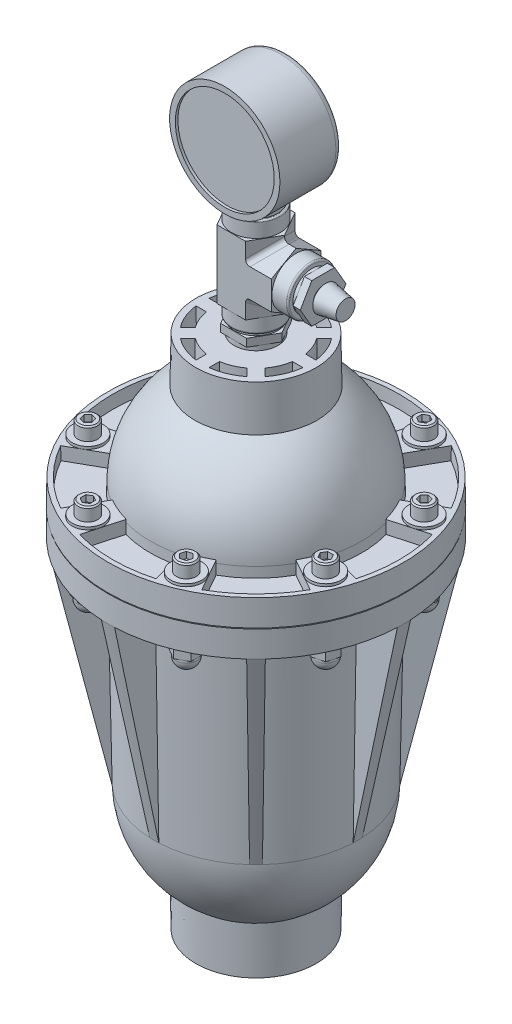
SolidWorks part; units mm, degrees
ref_plane "Front Plane" through (0, 0, 0) normal (0, 0, 1) x (1, 0, 0)
ref_plane "Top Plane" through (0, 0, 0) normal (0, 1, 0) x (1, 0, 0)
ref_plane "Right Plane" through (0, 0, 0) normal (1, 0, 0) x (0, 0, -1)
sketch "Sketch1" plane through (0, 0, 0) normal (0, 1, 0) x (1, 0, 0)
  circle A0 centre (0, 0) radius 72.39
  circle A1 centre (0, 0) radius 69.723
  dimension "D1" = 144.78
  dimension "D2" = 2.667
extrude "Boss-Extrude1" add sketch "Sketch1" along normal blind 12.7 draft 1
ref_plane "Plane1" through (0, -0.508, 0) normal (0, 1, 0) x (1, 0, 0)
sketch "Sketch5" plane through (0, 0, 0) normal (0, 1, 0) x (1, 0, 0)
  circle A0 centre (0, 0) radius 72.2624
extrude "Boss-Extrude5" add sketch "Sketch5" along normal blind 6.35
sketch "Sketch6" plane through (0, -0.508, 0) normal (0, 1, 0) x (1, 0, 0)
  circle A0 centre (0, 0) radius 59.4995
  dimension "D1" = 118.999
extrude "Boss-Extrude6" add sketch "Sketch6" along normal blind 6.35
sketch "Sketch7" plane through (0, -0.508, 0) normal (0, 1, 0) x (1, 0, 0)
  circle A0 centre (0, 0) radius 72.263
  circle A1 centre (0, 0) radius 69.596
  dimension "D1" = 2.667
extrude "Boss-Extrude7" add sketch "Sketch7" against normal blind 12.7 separate body
sketch "Sketch8" plane through (0, -0.508, 0) normal (0, 1, 0) x (1, 0, 0)
  circle A0 centre (0, 0) radius 72.263
extrude "Boss-Extrude8" add sketch "Sketch8" against normal blind 6.35 draft 1
sketch "Sketch9" plane through (0, 0, 0) normal (0, 1, 0) x (1, 0, 0)
  circle A0 centre (0, 0) radius 51.689
  dimension "D1" = 103.378
extrude "Boss-Extrude9" add sketch "Sketch9" along normal blind 59.944 draft 1
sketch "Sketch10" plane through (0, -0.508, 0) normal (0, 1, 0) x (1, 0, 0)
  circle A0 centre (0, 0) radius 51.689
extrude "Boss-Extrude10" add sketch "Sketch10" against normal blind 164.211 draft 1
ref_plane "Plane2" through (0, 73.533, 0) normal (0, 1, 0) x (1, 0, 0)
fillet "Fillet1" radius 49.53 2 edges at (0, -164.719, 48.8227) (0, 59.944, 50.6427)
ref_plane "Plane3" through (0, -178.308, 0) normal (0, 1, 0) x (1, 0, 0)
sketch "Sketch11" plane through (0, 73.533, 0) normal (0, 1, 0) x (1, 0, 0)
  circle A0 centre (0, 0) radius 29.337
  dimension "D1" = 58.674
extrude "Boss-Extrude11" add sketch "Sketch11" against normal up to surface (86.741 mm away) draft 1
sketch "Sketch12" plane through (0, -178.308, 0) normal (0, 1, 0) x (1, 0, 0)
  circle A0 centre (0, 0) radius 29.337
  dimension "D1" = 58.674
extrude "Boss-Extrude12" add sketch "Sketch12" along normal up to surface (191.008 mm away) draft 1
sketch "Sketch13" plane through (0, 73.533, 0) normal (0, 1, 0) x (1, 0, 0)
  circle A0 centre (0, 0) radius 21.209
  circle A1 centre (0, 0) radius 26.289
  dimension "D1" = 42.418
  dimension "D2" = 5.08
extrude "Cut-Extrude1" cut sketch "Sketch13" against normal blind 16.129 draft 1
sketch "Sketch14" plane through (0, -178.308, 0) normal (0, 1, 0) x (1, 0, 0)
  circle A0 centre (0, 0) radius 21.209
  circle A1 centre (0, 0) radius 26.289
  dimension "D1" = 42.418
  dimension "D2" = 5.08
extrude "Cut-Extrude2" cut sketch "Sketch14" along normal blind 16.129 draft 1
sketch "Sketch15" plane through (0, 73.533, 0) normal (0, 1, 0) x (1, 0, 0)
  line L0 (0, 0) -> (-38.2113, 0) construction
  line L1 (-27.5346, 3.175) -> (-18.5716, 3.175)
  line L2 (-18.5716, 3.175) -> (-18.5716, -3.175)
  line L3 (-18.5716, -3.175) -> (-27.5346, -3.175)
  line L4 (-27.5346, -3.175) -> (-27.5346, 3.175)
  dimension "D1" = 3.175
  dimension "D2" = 6.35
extrude "Boss-Extrude13" add sketch "Sketch15" against normal up to surface (16.129 mm away)
pattern_circular "CirPattern1" count 8 over 360 about axis through (0, 0, 0) along (0, 1, 0) of "Boss-Extrude13"
sketch "Sketch16" plane through (0, -178.308, 0) normal (0, 1, 0) x (1, 0, 0)
  line L0 (0, 0) -> (-34.5412, 0) construction
  line L1 (-27.7629, -3.175) -> (-18.9621, -3.175)
  line L2 (-18.9621, -3.175) -> (-18.9621, 3.175)
  line L3 (-18.9621, 3.175) -> (-27.7629, 3.175)
  line L4 (-27.7629, 3.175) -> (-27.7629, -3.175)
  dimension "D1" = 3.175
  dimension "D2" = 6.35
extrude "Boss-Extrude14" add sketch "Sketch16" along normal up to surface (16.129 mm away)
pattern_circular "CirPattern2" count 8 over 360 about axis through (0, 0, 0) along (0, 1, 0) of "Boss-Extrude14"
ref_plane "Plane4" through (0, 12.7, 0) normal (0, 1, 0) x (1, 0, 0)
ref_plane "Plane5" through (0, -13.208, 0) normal (0, 1, 0) x (1, 0, 0)
sketch "Sketch17" plane through (0, 12.7, 0) normal (0, 1, 0) x (1, 0, 0)
  line L0 (0, 0) -> (-75.9907, 0) construction
  line L1 (0, 0) -> (-73.6399, 20.4222) construction
  line L2 (0, 0) -> (-67.2134, 38.0275) construction
  line L3 (-44.5971, 12.3679) -> (-68.9898, 19.1326)
  line L4 (-68.9898, 19.1326) -> (-62.0787, 35.1224)
  line L5 (-62.0787, 35.1224) -> (-40.5245, 22.9277)
  line L6 (-40.5245, 22.9277) -> (-44.5971, 12.3679)
  dimension "D1" = 15.5
  dimension "D2" = 29.5
extrude "Boss-Extrude15" add sketch "Sketch17" against normal up to surface (6.35 mm away)
pattern_circular "CirPattern3" count 8 over 360 about axis through (0, 0, 0) along (0, 1, 0) of "Boss-Extrude15"
sketch "Sketch18" plane through (0, -13.208, 0) normal (0, 1, 0) x (1, 0, 0)
  line L0 (0, 0) -> (-75.9907, 0) construction
  line L1 (0, 0) -> (-73.2368, -20.3104) construction
  line L2 (0, 0) -> (-67.5571, -38.222) construction
  line L3 (-45.1438, -12.5195) -> (-68.6453, -19.037)
  line L4 (-68.6453, -19.037) -> (-62.1614, -35.1692)
  line L5 (-62.1614, -35.1692) -> (-39.9964, -22.6289)
  line L6 (-39.9964, -22.6289) -> (-45.1438, -12.5195)
  dimension "D1" = 15.5
  dimension "D2" = 29.5
extrude "Boss-Extrude16" add sketch "Sketch18" along normal up to surface (6.35 mm away)
pattern_circular "CirPattern4" count 8 over 360 about axis through (0, 0, 0) along (0, 1, 0) of "Boss-Extrude16"
sketch "Sketch19" plane through (0, 0, 0) normal (1, 0, 0) x (0, 0, -1)
  line L0 (-49.6721, -116.0534) -> (-45.7138, -113.2801)
  line L1 (-45.7138, -113.2801) -> (-47.6929, -3.4341)
  line L2 (-47.6929, -3.4341) -> (-69.7298, -3.4341)
  line L3 (-69.7298, -3.4341) -> (-72.263, -13.208)
  line L4 (79.629, -13.208) -> (-79.629, -13.208) construction
  line L5 (-72.263, -0.508) -> (-72.263, -13.208) construction
  line L6 (-72.263, -13.208) -> (-49.6721, -116.0534)
  line L7 (0, 0) -> (0, -189.5381) construction
revolve "Revolve1" add sketch "Sketch19" angle 5.1 mid plane about L7
pattern_circular "CirPattern5" count 8 over 360 about axis through (0, 0, 0) along (0, 1, 0) of "Revolve1"
sketch "Sketch20" plane through (0, 12.7, 0) normal (0, 1, 0) x (1, 0, 0)
  line L0 (0, 0) -> (-77.0276, 0) construction
  line L1 (0, 0) -> (-72.6743, 30.1027) construction
  circle A2 centre (0, 0) radius 62.8015 construction
  circle A3 centre (-58.021, 24.0331) radius 7.62
  dimension "D2" = 125.603
  dimension "D3" = 15.24
  dimension "D1" = 22.5
extrude "Boss-Extrude17" add sketch "Sketch20" along normal blind 1.27
sketch "Sketch21" plane through (0, -13.208, 0) normal (0, 1, 0) x (1, 0, 0)
  line L0 (0, 0) -> (-76.4604, -31.6669) construction
  line L1 (0, 0) -> (-79.4866, 0) construction
  circle A0 centre (0, 0) radius 62.8015 construction
  circle A1 centre (-58.0221, -24.0305) radius 7.62
  dimension "D1" = 125.603
  dimension "D2" = 15.24
extrude "Boss-Extrude18" add sketch "Sketch21" against normal blind 1.27
ref_plane "Plane6" through (0, 20.32, 0) normal (0, 1, 0) x (1, 0, 0)
sketch "Sketch22" plane through (0, 20.32, 0) normal (0, 1, 0) x (1, 0, 0)
  circle A0 centre (-58.021, 24.0331) radius 4.7625
  dimension "D1" = 9.525
extrude "Boss-Extrude19" add sketch "Sketch22" against normal up to surface (6.35 mm away)
sketch "Sketch23" plane through (0, 20.32, 0) normal (0, 1, 0) x (1, 0, 0)
  line L1 (-60.7707, 24.0331) -> (-59.3958, 21.6518)
  line L2 (-59.3958, 21.6518) -> (-56.6462, 21.6518)
  line L3 (-56.6462, 21.6518) -> (-55.2714, 24.0331)
  line L4 (-55.2714, 24.0331) -> (-56.6462, 26.4143)
  line L5 (-56.6462, 26.4143) -> (-59.3958, 26.4143)
  line L6 (-59.3958, 26.4143) -> (-60.7707, 24.0331)
  circle A0 centre (-58.021, 24.0331) radius 2.3812 construction
extrude "Cut-Extrude3" cut sketch "Sketch23" against normal blind 3.048
chamfer "Chamfer1" distance 0.635 angle 45 1 edges at (-58.021, 20.32, -19.2706)
sketch "Sketch24" plane through (0, -13.208, 0) normal (0, 1, 0) x (1, 0, 0)
  line L1 (-64.1813, -24.0305) -> (-61.1017, -29.3645)
  line L2 (-61.1017, -29.3645) -> (-54.9425, -29.3645)
  line L3 (-54.9425, -29.3645) -> (-51.8629, -24.0305)
  line L4 (-51.8629, -24.0305) -> (-54.9425, -18.6965)
  line L5 (-54.9425, -18.6965) -> (-61.1017, -18.6965)
  line L6 (-61.1017, -18.6965) -> (-64.1813, -24.0305)
  circle A0 centre (-58.0221, -24.0305) radius 5.334 construction
extrude "Boss-Extrude20" add sketch "Sketch24" against normal blind 6.858
sketch "Sketch25" plane through (0, -13.208, 0) normal (0, 1, 0) x (1, 0, 0)
  circle A0 centre (-58.0221, -24.0305) radius 5.207
  dimension "D1" = 10.414
extrude "Boss-Extrude21" add sketch "Sketch25" against normal blind 13.208
fillet "Fillet2" radius 5.08 1 edges at (-58.0221, -26.416, 29.2375)
pattern_circular "CirPattern6" count 8 over 360 about axis through (0, 0, 0) along (0, 1, 0) of "Boss-Extrude17", "Boss-Extrude18", "Boss-Extrude19", "Cut-Extrude3", "Chamfer1", "Boss-Extrude20", "Boss-Extrude21", "Fillet2"
hole_wizard "1 NPT Tapped Hole3" positions "Sketch31" profile "Sketch30" size "1" standard "ANSI Inch"
sketch "Sketch31" plane through (0, -178.308, 0) normal (0, -1, 0) x (-1, 0, 0)
  point P0 (0, 0)
sketch "Sketch30" plane through (0, -178.308, 0) normal (1, 0, 0) x (0, 0, -1)
  line L0 (0, 0) -> (0, 36.6469)
  line L1 (14.4907, 27.94) -> (0, 36.6469)
  line L2 (-14.4907, 27.94) -> (0, 36.6469) construction
  line L3 (14.4907, 27.94) -> (14.4907, 16.764)
  line L4 (14.4907, 16.764) -> (15.228, 16.764)
  line L5 (15.228, 16.764) -> (15.7299, 0)
  line L6 (-15.228, 16.764) -> (-15.7299, 0) construction
  line L7 (15.7299, 0) -> (0, 0)
  line L8 (0, -6.35) -> (0, 107.95) construction
  line L11 (-14.4907, 16.764) -> (-15.228, 16.764) construction
  dimension "Tap Drill Dia." = 28.9814
  dimension "Tap Drill Depth" = 27.94
  dimension "Thread Dia." = 31.4598
  dimension "Thread Angle" = 3.43
  dimension "Thread Depth" = 16.764
  dimension "Drill Angle" = 118
sketch "Sketch32" plane through (0, 73.533, 0) normal (0, 1, 0) x (1, 0, 0)
  circle A0 centre (0, 0) radius 10.668
  dimension "D1" = 21.336
extrude "Boss-Extrude22" add sketch "Sketch32" along normal blind 84.836
sketch "Sketch33" plane through (0, 0, 0) normal (0, 0, 1) x (1, 0, 0)
  line L0 (10.668, 158.369) -> (-10.668, 158.369) construction
  circle A0 centre (0, 158.369) radius 26.924
  dimension "D1" = 53.848
extrude "Boss-Extrude23" add sketch "Sketch33" along normal mid plane 30.48
ref_plane "Plane9" through (0, 76.073, 0) normal (0, 1, 0) x (1, 0, 0)
ref_plane "Plane10" through (0, 81.153, 0) normal (0, 1, 0) x (1, 0, 0)
ref_plane "Plane11" through (0, 88.519, 0) normal (0, 1, 0) x (1, 0, 0)
sketch "Sketch34" plane through (0, 76.073, 0) normal (0, 1, 0) x (1, 0, 0)
  line L1 (-12.6116, 0) -> (-6.3058, -10.922)
  line L2 (-6.3058, -10.922) -> (6.3058, -10.922)
  line L3 (6.3058, -10.922) -> (12.6116, 0)
  line L4 (12.6116, 0) -> (6.3058, 10.922)
  line L5 (6.3058, 10.922) -> (-6.3058, 10.922)
  line L6 (-6.3058, 10.922) -> (-12.6116, 0)
  circle A0 centre (0, 0) radius 10.922 construction
extrude "Boss-Extrude24" add sketch "Sketch34" along normal blind 3.81
sketch "Sketch35" plane through (0, 81.153, 0) normal (0, 1, 0) x (1, 0, 0)
  circle A0 centre (0, 0) radius 11.811
  dimension "D1" = 23.622
extrude "Boss-Extrude25" add sketch "Sketch35" along normal blind 48.26
sketch "Sketch36" plane through (0, 88.519, 0) normal (0, 1, 0) x (1, 0, 0)
  line L1 (-13.9315, 0) -> (-6.9657, -12.065)
  line L2 (-6.9657, -12.065) -> (6.9657, -12.065)
  line L3 (6.9657, -12.065) -> (13.9315, 0)
  line L4 (13.9315, 0) -> (6.9657, 12.065)
  line L5 (6.9657, 12.065) -> (-6.9657, 12.065)
  line L6 (-6.9657, 12.065) -> (-13.9315, 0)
  circle A0 centre (0, 0) radius 12.065 construction
extrude "Boss-Extrude26" add sketch "Sketch36" along normal blind 33.274
ref_plane "Plane12" through (19.558, 0, 0) normal (1, 0, 0) x (0, 0, -1)
ref_plane "Plane13" through (27.432, 0, 0) normal (1, 0, 0) x (0, 0, -1)
sketch "Sketch44" plane through (27.432, 0, 0) normal (1, 0, 0) x (0, 0, -1)
  line L0 (0, 121.793) -> (0, 88.519) construction
  circle A0 centre (0, 105.156) radius 11.811
  dimension "D1" = 23.622
extrude "Boss-Extrude30" add sketch "Sketch44" against normal blind 27.432
sketch "Sketch45" plane through (19.558, 0, 0) normal (1, 0, 0) x (0, 0, -1)
  line L0 (0, 121.793) -> (0, 88.519) construction
  line L1 (0, 119.0875) -> (-12.065, 112.1217)
  line L2 (-12.065, 112.1217) -> (-12.065, 98.1903)
  line L3 (-12.065, 98.1903) -> (0, 91.2245)
  line L4 (0, 91.2245) -> (12.065, 98.1903)
  line L5 (12.065, 98.1903) -> (12.065, 112.1217)
  line L6 (12.065, 112.1217) -> (0, 119.0875)
  circle A0 centre (0, 105.156) radius 12.065 construction
extrude "Boss-Extrude31" add sketch "Sketch45" against normal blind 19.558
ref_plane "Plane14" through (32.766, 0, 0) normal (1, 0, 0) x (0, 0, -1)
sketch "Sketch46" plane through (32.766, 0, 0) normal (1, 0, 0) x (0, 0, -1)
  line L0 (0, 121.793) -> (0, 88.519) construction
  circle A0 centre (0, 105.156) radius 9.398
  dimension "D1" = 18.796
extrude "Boss-Extrude32" add sketch "Sketch46" against normal up to surface (5.334 mm away)
sketch "Sketch47" plane through (32.766, 0, 0) normal (1, 0, 0) x (0, 0, -1)
  line L0 (0, 121.793) -> (0, 88.519) construction
  line L1 (-11.1452, 105.156) -> (-5.5726, 95.504)
  line L2 (-5.5726, 95.504) -> (5.5726, 95.504)
  line L3 (5.5726, 95.504) -> (11.1452, 105.156)
  line L4 (11.1452, 105.156) -> (5.5726, 114.808)
  line L5 (5.5726, 114.808) -> (-5.5726, 114.808)
  line L6 (-5.5726, 114.808) -> (-11.1452, 105.156)
  circle A0 centre (0, 105.156) radius 9.652 construction
extrude "Boss-Extrude33" add sketch "Sketch47" against normal blind 3.556
ref_plane "Plane15" through (34.036, 0, 0) normal (1, 0, 0) x (0, 0, -1)
sketch "Sketch48" plane through (34.036, 0, 0) normal (1, 0, 0) x (0, 0, -1)
  line L0 (0, 121.793) -> (0, 88.519) construction
  circle A0 centre (0, 105.156) radius 4.826
  dimension "D1" = 9.652
extrude "Boss-Extrude34" add sketch "Sketch48" against normal up to surface (1.27 mm away)
sketch "Sketch49" plane through (34.036, 0, 0) normal (1, 0, 0) x (0, 0, -1)
  circle A0 centre (0, 105.156) radius 6.35
extrude "Boss-Extrude35" add sketch "Sketch49" along normal blind 9.652 draft 10
fillet "Fillet3" radius 0.762 3 edges at (0, 81.153, 11.811) (27.432, 105.156, -11.811) (0, 129.413, 11.811)
fillet "Fillet4" radius 2.54 4 edges at (10.4486, 94.7074, -6.0325) (10.4486, 94.7074, 6.0325) (10.4486, 115.6046, -6.0325) (10.4486, 115.6046, 6.0325)
fillet "Fillet5" radius 3.175 1 edges at (26.924, 158.369, -15.24)
ref_plane "Plane16" through (0, 0, 15.24) normal (0, 0, 1) x (1, 0, 0)
sketch "Sketch50" plane through (0, 0, 15.24) normal (0, 0, 1) x (1, 0, 0)
  circle A0 centre (0, 158.369) radius 24.13
  dimension "D1" = 48.26
extrude "Cut-Extrude4" cut sketch "Sketch50" against normal blind 1.27
